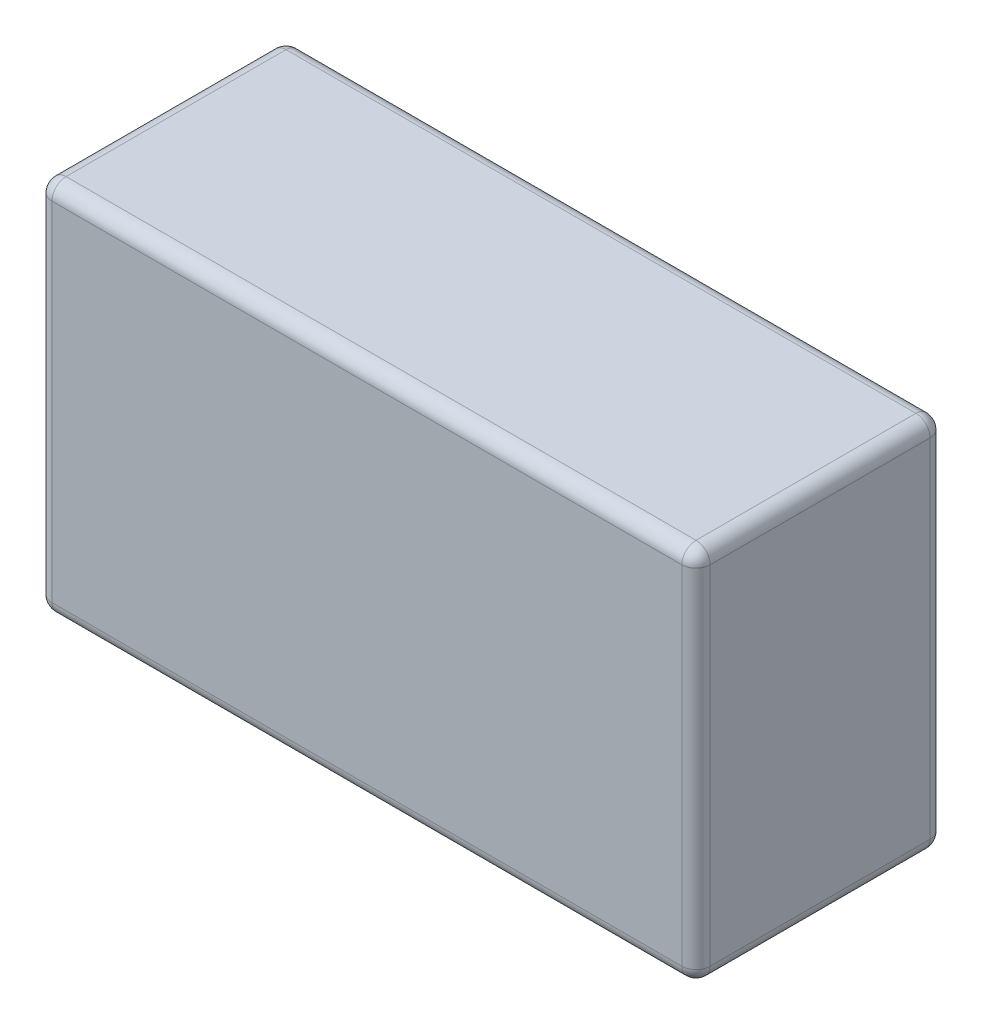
SolidWorks part; units mm, degrees
ref_plane "Front Plane" through (0, 0, 0) normal (0, 0, 1) x (1, 0, 0)
ref_plane "Top Plane" through (0, 0, 0) normal (0, 1, 0) x (1, 0, 0)
ref_plane "Right Plane" through (0, 0, 0) normal (1, 0, 0) x (0, 0, -1)
sketch "Sketch1" plane through (0, 0, 0) normal (0, 0, 1) x (1, 0, 0)
  line L1 (0, 0) -> (46.4, 0)
  line L2 (0, 0) -> (0, 26.5)
  line L3 (0, 26.5) -> (46.4, 26.5)
  line L4 (46.4, 0) -> (46.4, 26.5)
  dimension "D1" = 46.4
  dimension "D2" = 26.5
extrude "Boss-Extrude2" add sketch "Sketch1" along normal blind 17.5
sketch "Sketch2" plane through (0, 0, 0) normal (-1, 0, 0) x (0, 0, 1)
  line L0 (17.5, 26.5) -> (0, 26.5) construction
  line L1 (10.5289, 3.5206) -> (12.6009, 6.9905)
  line L2 (12.6009, 6.9905) -> (10.6319, 10.5199)
  line L3 (10.6319, 10.5199) -> (6.5909, 10.5794)
  line L4 (6.5909, 10.5794) -> (4.5189, 7.1095)
  line L5 (4.5189, 7.1095) -> (6.4879, 3.5801)
  line L6 (6.4879, 3.5801) -> (10.5289, 3.5206)
  line L7 (0, 26.5) -> (0, 0) construction
  circle A0 centre (8.75, 20) radius 3.5
  circle A1 centre (8.5599, 7.05) radius 3.5 construction
  dimension "D1" = 7
  dimension "D2" = 7
  dimension "D3" = 12.95
  dimension "D4" = 6.5
  dimension "D5" = 8.75
extrude "Boss-Extrude3" add sketch "Sketch2" along normal blind 2
fillet "Fillet1" radius 1 12 edges at (46.4, 0, 8.75) (46.4, 13.25, 0) (46.4, 26.5, 8.75) (46.4, 13.25, 17.5) (23.2, 0, 17.5) (0, 0, 8.75) (23.2, 0, 0) (0, 13.25, 0) (23.2, 26.5, 0) (23.2, 26.5, 17.5) (0, 13.25, 17.5) (0, 26.5, 8.75)
